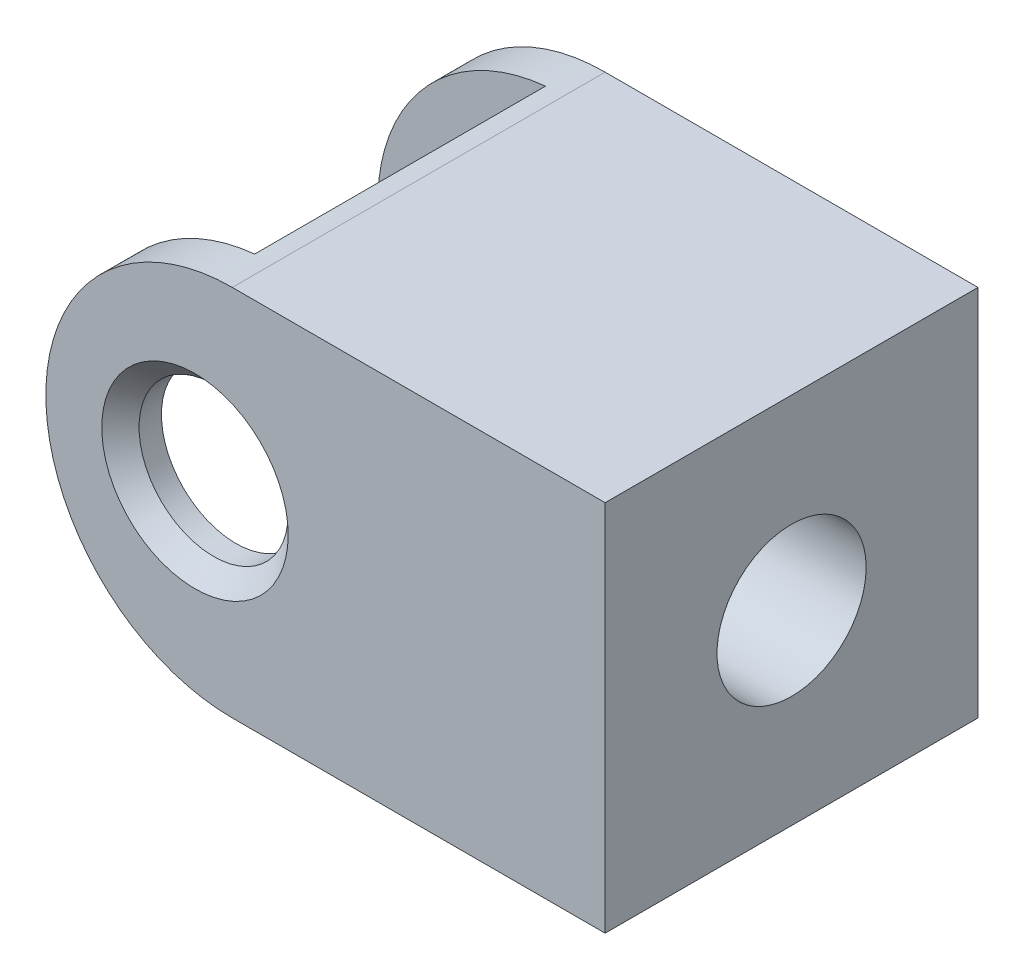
SolidWorks part; units mm, degrees
ref_plane "Ön Düzlem" through (0, 0, 0) normal (0, 0, 1) x (1, 0, 0)
ref_plane "Üst Düzlem" through (0, 0, 0) normal (0, 1, 0) x (1, 0, 0)
ref_plane "Sağ Düzlem" through (0, 0, 0) normal (1, 0, 0) x (0, 0, -1)
sketch "Çizim1" plane through (0, 0, 0) normal (0, 0, 1) x (1, 0, 0)
  line L0 (0, 10) -> (20, 10)
  line L1 (20, 10) -> (20, -10)
  line L2 (20, -10) -> (0, -10)
  arc A0 (0, 10) -> (0, -10) centre (0, 0) ccw
  dimension "D1" = 20
  dimension "D2" = 20
extrude "Yükseklik-Ekstrüzyon1" add sketch "Çizim1" along normal blind 20
ref_plane "Düzlem1" through (0, 0, 10) normal (0, 0, 1) x (1, 0, 0)
sketch "Çizim2" plane through (0, 0, 10) normal (0, 0, 1) x (1, 0, 0)
  circle A0 centre (-2, 0) radius 10
  dimension "D1" = 20
  dimension "D2" = 2
extrude "Kes-Ekstrüzyon1" cut sketch "Çizim2" against normal blind 7.8 and the other way blind 7.8
sketch "Çizim3" plane through (0, 0, 20) normal (0, 0, 1) x (1, 0, 0)
  circle A0 centre (-2, 0) radius 4
  dimension "D1" = 8
  dimension "D2" = 2
extrude "Kes-Ekstrüzyon2" cut sketch "Çizim3" against normal blind 35.8
sketch "Çizim4" plane through (20, 0, 0) normal (1, 0, 0) x (0, 0, -1)
  line L0 (0, -10) -> (0, 10) construction
  circle A0 centre (-10, 0) radius 4
  dimension "D1" = 10
  dimension "D2" = 8
extrude "Kes-Ekstrüzyon3" cut sketch "Çizim4" against normal blind 8
chamfer "Pah1" distance 1 angle 45 2 edges at (2, 0, 20) (2, 0, 0)
